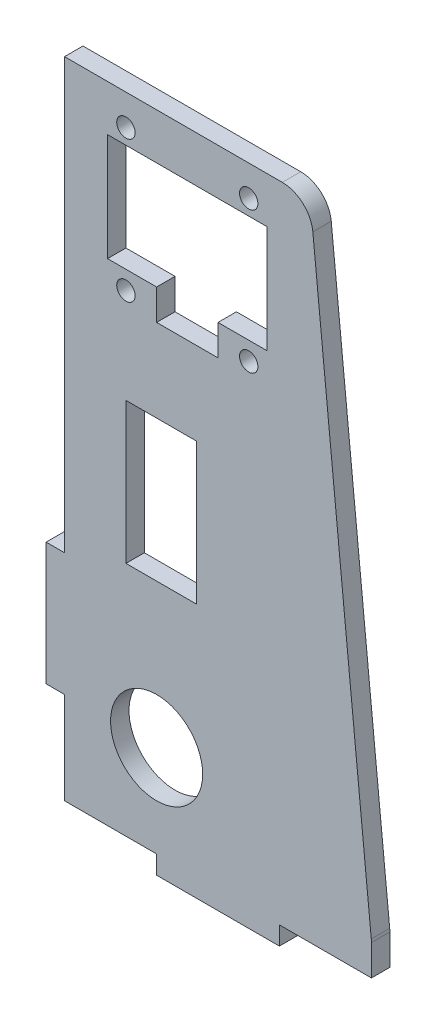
SolidWorks part; units mm, degrees
ref_plane "Plan de face" through (0, 0, 0) normal (0, 0, 1) x (1, 0, 0)
ref_plane "Plan de dessus" through (0, 0, 0) normal (0, 1, 0) x (1, 0, 0)
ref_plane "Plan de droite" through (0, 0, 0) normal (1, 0, 0) x (0, 0, -1)
sketch "Esquisse1" plane through (0, 0, 0) normal (0, 0, 1) x (1, 0, 0)
  line L0 (0, 0) -> (0, 15)
  line L1 (0, 15) -> (-3, 15)
  line L2 (-3, 15) -> (-3, 35)
  line L3 (-3, 35) -> (0, 35)
  line L4 (0, 35) -> (0, 105)
  line L6 (50, 0) -> (35, 0)
  line L7 (0, 105) -> (35.4762, 105)
  line L8 (40.4513, 100.4988) -> (49.9751, 5.4988)
  line L9 (50, 5) -> (50, 0)
  line L10 (15, 0) -> (15, -3)
  line L11 (10, 61.5) -> (21.5, 61.5)
  line L12 (10, 61.5) -> (10, 38.5)
  line L13 (10, 38.5) -> (21.5, 38.5)
  line L14 (21.5, 61.5) -> (21.5, 38.5)
  line L15 (15, -3) -> (35, -3)
  line L16 (35, -3) -> (35, 0)
  line L17 (15, 0) -> (0, 0)
  line L18 (0, 100) -> (47.4955, 100) construction
  line L19 (7, 97.5) -> (33, 97.5)
  line L20 (33, 97.5) -> (33, 80)
  line L21 (33, 80) -> (25, 80)
  line L22 (25, 80) -> (25, 75)
  line L23 (25, 75) -> (15, 75)
  line L24 (15, 75) -> (15, 80)
  line L25 (15, 80) -> (7, 80)
  line L26 (7, 80) -> (7, 97.5)
  line L27 (10, 100) -> (10, 77) construction
  line L28 (30, 100) -> (30, 77) construction
  line L29 (30, 77) -> (10, 77) construction
  arc A0 (49.9751, 5.4988) -> (50, 5) centre (45, 5) cw
  arc A1 (35.4762, 105) -> (40.4513, 100.4988) centre (35.4762, 100) cw
  circle A2 centre (10, 100) radius 1.5
  circle A3 centre (30, 100) radius 1.5
  circle A4 centre (10, 77) radius 1.5
  circle A5 centre (30, 77) radius 1.5
  circle A6 centre (15, 15) radius 7.5
  point P14 (40, 105)
  point P19 (10, 50)
  dimension "D6" = 5
  dimension "D9" = 5
  dimension "D10" = 11.5
  dimension "D25" = 3
  dimension "D26" = 3
  dimension "D27" = 10
  dimension "D30" = 3
  dimension "D31" = 3
  dimension "D33" = 15
  dimension "D35" = 15
  dimension "D1" = 15
  dimension "D2" = 70
  dimension "D3" = 20
  dimension "D4" = 3
  dimension "D5" = 50
  dimension "D7" = 40
  dimension "D8" = 5
  dimension "D11" = 23
  dimension "D12" = 10
  dimension "D13" = 50
  dimension "D14" = 15
  dimension "D15" = 15
  dimension "D16" = 3
  dimension "D17" = 5
  dimension "D18" = 26
  dimension "D19" = 17.5
  dimension "D20" = 8
  dimension "D21" = 8
  dimension "D22" = 5
  dimension "D23" = 7
  dimension "D24" = 20
  dimension "D28" = 2.5
  dimension "D29" = 23
  dimension "D32" = 17.5
  dimension "D34" = 15
extrude "Boss.-Extru.1" add sketch "Esquisse1" along normal blind 3
